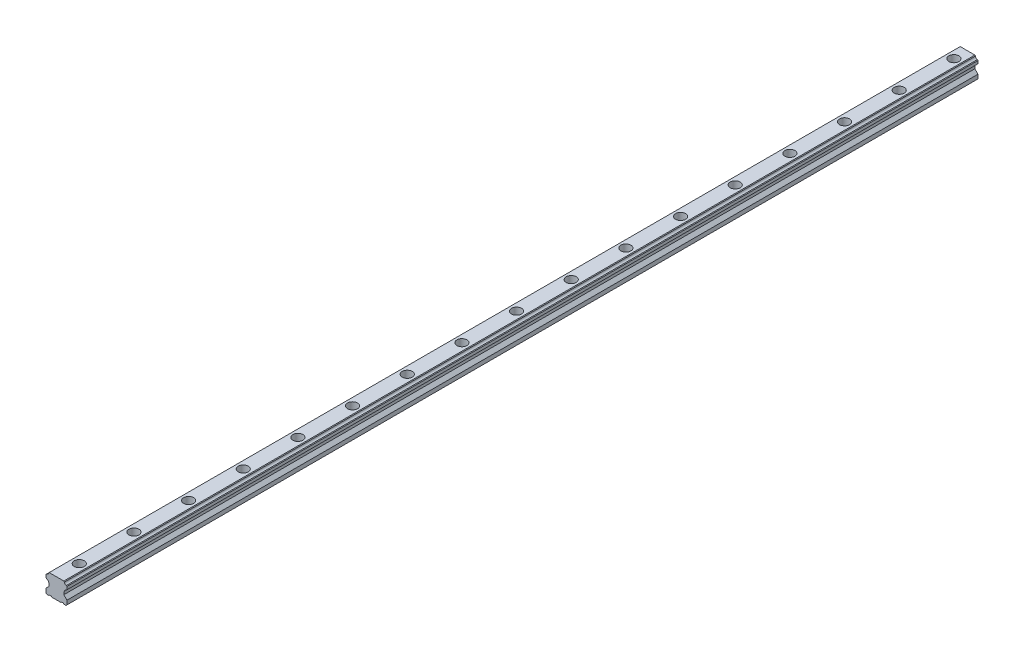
SolidWorks part; units mm, degrees
ref_plane "Front Plane" through (0, 0, 0) normal (0, 0, 1) x (1, 0, 0)
ref_plane "Top Plane" through (0, 0, 0) normal (0, 1, 0) x (1, 0, 0)
ref_plane "Right Plane" through (0, 0, 0) normal (1, 0, 0) x (0, 0, -1)
sketch "Sketch2" plane through (0, 0, 0) normal (0, 0, 1) x (1, 0, 0)
  line L0 (-8.402, -11.4692) -> (-7.6353, -10.7025)
  line L1 (-7.6353, -10.7025) -> (-5.8829, -10.7025)
  line L2 (-5.8829, -10.7025) -> (-5.1163, -11.4692)
  line L3 (-5.1163, -11.4692) -> (4.7409, -11.4692)
  line L4 (4.7409, -11.4692) -> (5.5076, -10.7025)
  line L5 (5.5076, -10.7025) -> (7.2599, -10.7025)
  line L6 (7.2599, -10.7025) -> (8.0266, -11.4692)
  line L7 (8.0266, -11.4692) -> (10.3123, -11.4692)
  line L8 (10.3123, -11.4692) -> (11.3123, -10.4692)
  line L9 (11.3123, -10.4692) -> (11.3123, -5.9692)
  line L10 (11.3123, -5.9692) -> (7.8623, -2.5192)
  line L11 (7.8623, -2.5192) -> (7.8623, 0.4808)
  line L12 (7.8623, 0.4808) -> (8.5116, 1.1301)
  line L13 (10.663, 3.2815) -> (11.3123, 3.9308)
  line L14 (11.3123, 3.9308) -> (11.3123, 7.0808)
  line L15 (11.3123, 7.0808) -> (10.663, 7.7301)
  line L16 (8.5116, 9.8815) -> (7.8623, 10.5308)
  line L17 (7.8623, 10.5308) -> (-8.2377, 10.5308)
  line L18 (-8.2377, 10.5308) -> (-8.887, 9.8815)
  line L19 (-11.0384, 7.7301) -> (-11.6877, 7.0808)
  line L20 (-11.6877, 7.0808) -> (-11.6877, 3.9308)
  line L21 (-11.6877, 3.9308) -> (-11.0384, 3.2815)
  line L22 (-8.887, 1.1301) -> (-8.2377, 0.4808)
  line L23 (-8.2377, 0.4808) -> (-8.2377, -2.5192)
  line L24 (-8.2377, -2.5192) -> (-11.6877, -5.9692)
  line L25 (-11.6877, -5.9692) -> (-11.6877, -10.4692)
  line L26 (-11.6877, -10.4692) -> (-10.6877, -11.4692)
  line L27 (-10.6877, -11.4692) -> (-8.402, -11.4692)
  arc A0 (10.663, 3.2815) -> (8.5116, 1.1301) centre (10.8071, 0.986) ccw
  arc A1 (8.5116, 9.8815) -> (10.663, 7.7301) centre (10.8071, 10.0256) ccw
  arc A2 (-11.0384, 7.7301) -> (-8.887, 9.8815) centre (-11.1824, 10.0256) ccw
  arc A3 (-8.887, 1.1301) -> (-11.0384, 3.2815) centre (-11.1824, 0.986) ccw
extrude "Boss-Extrude1" add sketch "Sketch2" along normal blind 1000
sketch "Sketch3" plane through (0, 10.5308, 0) normal (0, 1, 0) x (1, 0, 0)
  line L0 (7.8623, 0) -> (-8.2377, 0) construction
  line L1 (11.3123, -1000) -> (11.3123, 0) construction
  point P0 (-0.1877, -15)
  dimension "D1" = 15
  dimension "D2" = 11.5
hole_wizard "CBORE for M16 Hex Head Bolt1" positions "Sketch3" profile "Sketch4" counterbore size "M16" standard "DIN"
sketch "Sketch4" plane through (-0.1877, 10.5308, 15) normal (1, 0, 0) x (0, 0, 1)
  line L0 (0, 0) -> (0, 22)
  line L1 (0, 22) -> (3.5, 22)
  line L3 (3.5, 22) -> (3.5, 9)
  line L4 (3.5, 9) -> (5.5, 9)
  line L5 (5.5, 9) -> (5.5, 0)
  line L7 (5.5, 0) -> (0, 0)
  line L11 (0, -6.35) -> (0, 107.95) construction
  dimension "Thru Hole Dia." = 7
  dimension "Thru Hole Depth" = 22
  dimension "C'Bore Dia." = 11
  dimension "C'Bore Depth" = 9
other "Fill Pattern1" parameters "D5"=0, "D6"=0, "D1"=60, "D2"=60, "D3"=0, "D9"=17, "D7"=17, "D8"=2
